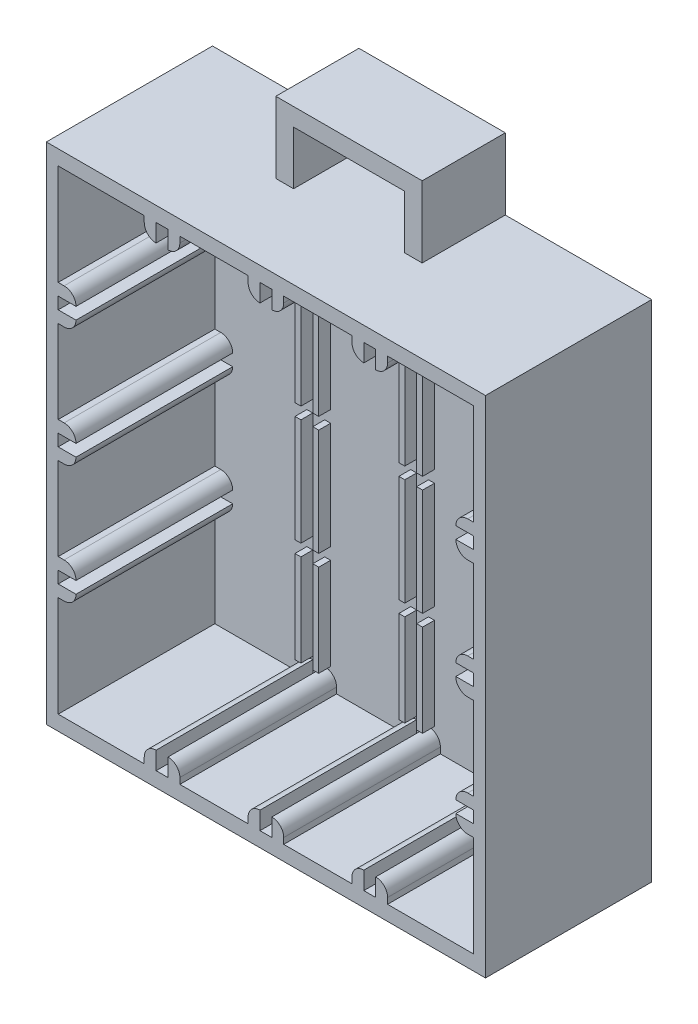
SolidWorks part; units mm, degrees
ref_plane "Alzado" through (0, 0, 0) normal (0, 0, 1) x (1, 0, 0)
ref_plane "Planta" through (0, 0, 0) normal (0, 1, 0) x (1, 0, 0)
ref_plane "Vista lateral" through (0, 0, 0) normal (1, 0, 0) x (0, 0, -1)
sketch "Croquis1" plane through (0, 0, 0) normal (0, 0, -1) x (-1, 0, 0)
  line L1 (-37, 42.5) -> (37, 42.5)
  line L2 (-37, 42.5) -> (-37, -42.5)
  line L3 (-37, -42.5) -> (37, -42.5)
  line L4 (37, 42.5) -> (37, -42.5)
  dimension "D1" = 85
  dimension "D2" = 74
extrude "Saliente-Extruir1" add sketch "Croquis1" against normal blind 1.6 separate body
sketch "Croquis4" plane through (0, 0, 1.6) normal (0, 0, 1) x (1, 0, 0)
  line L0 (-37, 42.5) -> (37, 42.5) construction
  line L1 (-35, 40) -> (35, 40)
  line L2 (-35, 40) -> (-35, -40)
  line L3 (-35, -40) -> (35, -40)
  line L4 (35, 40) -> (35, -40)
  line L5 (37, -42.5) -> (-37, -42.5)
  line L6 (37, -42.5) -> (37, 42.5)
  line L7 (37, 42.5) -> (-37, 42.5)
  line L8 (-37, -42.5) -> (-37, 42.5)
  line L9 (37, 42.5) -> (37, -42.5) construction
  dimension "D1" = 85
  dimension "D2" = 2.5
  dimension "D3" = 80
  dimension "D4" = 70
  dimension "D5" = 2
extrude "Saliente-Extruir2" add sketch "Croquis4" along normal blind 26.4
sketch "Croquis5" plane through (0, 0, 0) normal (0, 0, -1) x (-1, 0, 0)
  line L0 (-12.3333, 42.5) -> (-12.3333, 54.5)
  line L1 (-12.3333, 54.5) -> (12.3333, 54.5)
  line L2 (12.3333, 54.5) -> (12.3333, 42.5)
  line L3 (12.3333, 42.5) -> (9.3333, 42.5)
  line L4 (9.3333, 42.5) -> (9.3333, 51.5)
  line L5 (9.3333, 51.5) -> (-9.3333, 51.5)
  line L6 (-9.3333, 51.5) -> (-9.3333, 42.5)
  line L7 (-9.3333, 42.5) -> (-12.3333, 42.5)
extrude "Saliente-Extruir3" add sketch "Croquis5" against normal blind 14
sketch "Croquis8" plane through (-35, 0, 0) normal (1, 0, 0) x (0, 0, -1)
  line L0 (-1.6, 40) -> (-1.6, -40) construction
  line L1 (-1.6, -23) -> (-28, -23)
  line L2 (-1.6, -23) -> (-1.6, -21)
  line L3 (-1.6, -21) -> (-28, -21)
  line L4 (-28, -23) -> (-28, -21)
  line L5 (-28, 40) -> (-28, -40) construction
  line L6 (-28, -40) -> (-1.6, -40) construction
  line L7 (-1.6, -19) -> (-28, -19)
  line L8 (-1.6, -19) -> (-1.6, -17)
  line L9 (-1.6, -17) -> (-28, -17)
  line L10 (-28, -19) -> (-28, -17)
  line L11 (-1.6, -3) -> (-28, -3)
  line L12 (-1.6, -3) -> (-1.6, -1)
  line L13 (-1.6, -1) -> (-28, -1)
  line L14 (-28, -3) -> (-28, -1)
  line L15 (-1.6, 1) -> (-28, 1)
  line L16 (-1.6, 1) -> (-1.6, 3)
  line L17 (-1.6, 3) -> (-28, 3)
  line L18 (-28, 1) -> (-28, 3)
  line L19 (-1.6, 17) -> (-28, 17)
  line L20 (-1.6, 17) -> (-1.6, 19)
  line L21 (-1.6, 19) -> (-28, 19)
  line L22 (-28, 17) -> (-28, 19)
  line L23 (-1.6, 21) -> (-28, 21)
  line L24 (-1.6, 21) -> (-1.6, 23)
  line L25 (-1.6, 23) -> (-28, 23)
  line L26 (-28, 21) -> (-28, 23)
  dimension "D1" = 2
  dimension "D2" = 2
  dimension "D3" = 2
  dimension "D4" = 17
  dimension "D5" = 3
extrude "Saliente-Extruir4" add sketch "Croquis8" along normal blind 3
sketch "Croquis9" plane through (35, 0, 0) normal (-1, 0, 0) x (0, 0, 1)
  line L0 (28, -40) -> (28, 40) construction
  line L1 (28, -23) -> (1.6, -23)
  line L2 (28, -23) -> (28, -21)
  line L3 (28, -21) -> (1.6, -21)
  line L4 (1.6, -23) -> (1.6, -21)
  line L5 (1.6, -40) -> (1.6, 40) construction
  line L6 (28, -40) -> (1.6, -40) construction
  line L7 (28, -19) -> (1.6, -19)
  line L8 (28, -19) -> (28, -17)
  line L9 (28, -17) -> (1.6, -17)
  line L10 (1.6, -19) -> (1.6, -17)
  line L11 (28, -3) -> (1.6, -3)
  line L12 (28, -1) -> (1.6, -1)
  line L13 (1.6, -3) -> (1.6, -1)
  line L14 (1.6, 1) -> (1.6, 3)
  line L15 (28, 1) -> (1.6, 1)
  line L16 (28, 3) -> (1.6, 3)
  line L17 (28, 1) -> (28, 3)
  line L18 (28, -3) -> (28, -1)
  line L19 (28, 17) -> (1.6, 17)
  line L20 (28, 19) -> (1.6, 19)
  line L21 (1.6, 17) -> (1.6, 19)
  line L22 (1.6, 21) -> (1.6, 23)
  line L23 (28, 21) -> (1.6, 21)
  line L24 (28, 23) -> (1.6, 23)
  line L25 (28, 21) -> (28, 23)
  line L26 (28, 17) -> (28, 19)
  dimension "D1" = 2
  dimension "D2" = 2
  dimension "D3" = 2
  dimension "D4" = 19
  dimension "D5" = 3
extrude "Saliente-Extruir5" add sketch "Croquis9" along normal blind 3
sketch "Croquis10" plane through (0, -40, 0) normal (0, 1, 0) x (1, 0, 0)
  line L0 (-35, -1.6) -> (35, -1.6) construction
  line L1 (-20.5, -1.6) -> (-18.5, -1.6)
  line L2 (-20.5, -1.6) -> (-20.5, -28)
  line L3 (-20.5, -28) -> (-18.5, -28)
  line L4 (-18.5, -1.6) -> (-18.5, -28)
  line L5 (-35, -28) -> (35, -28) construction
  line L6 (-35, -28) -> (-35, -1.6) construction
  line L7 (-16.5, -1.6) -> (-14.5, -1.6)
  line L8 (-16.5, -1.6) -> (-16.5, -28)
  line L9 (-16.5, -28) -> (-14.5, -28)
  line L10 (-14.5, -1.6) -> (-14.5, -28)
  line L11 (3, -1.6) -> (3, -28)
  line L12 (1, -1.6) -> (1, -28)
  line L13 (-1, -1.6) -> (-1, -28)
  line L14 (-3, -1.6) -> (-3, -28)
  line L15 (1, -28) -> (3, -28)
  line L16 (-3, -28) -> (-1, -28)
  line L17 (1, -1.6) -> (3, -1.6)
  line L18 (-3, -1.6) -> (-1, -1.6)
  line L19 (20.5, -1.6) -> (20.5, -28)
  line L20 (18.5, -1.6) -> (18.5, -28)
  line L21 (16.5, -1.6) -> (16.5, -28)
  line L22 (14.5, -1.6) -> (14.5, -28)
  line L23 (18.5, -28) -> (20.5, -28)
  line L24 (14.5, -28) -> (16.5, -28)
  line L25 (18.5, -1.6) -> (20.5, -1.6)
  line L26 (14.5, -1.6) -> (16.5, -1.6)
  dimension "D1" = 2
  dimension "D2" = 2
  dimension "D3" = 2
  dimension "D4" = 16.5
  dimension "D5" = 3
extrude "Saliente-Extruir6" add sketch "Croquis10" along normal blind 3
sketch "Croquis11" plane through (0, 40, 0) normal (0, -1, 0) x (1, 0, 0)
  line L0 (35, 1.6) -> (-35, 1.6) construction
  line L1 (-20.5, 1.6) -> (-18.5, 1.6)
  line L2 (-20.5, 1.6) -> (-20.5, 28)
  line L3 (-20.5, 28) -> (-18.5, 28)
  line L4 (-18.5, 1.6) -> (-18.5, 28)
  line L5 (35, 28) -> (-35, 28) construction
  line L7 (-16.5, 1.6) -> (-14.5, 1.6)
  line L8 (-16.5, 1.6) -> (-16.5, 28)
  line L9 (-16.5, 28) -> (-14.5, 28)
  line L10 (-14.5, 1.6) -> (-14.5, 28)
  line L11 (-35, 28) -> (-35, 1.6) construction
  line L12 (-3, 1.6) -> (-3, 28)
  line L13 (-1, 1.6) -> (-1, 28)
  line L14 (1, 1.6) -> (1, 28)
  line L15 (3, 1.6) -> (3, 28)
  line L16 (1, 28) -> (3, 28)
  line L17 (-3, 28) -> (-1, 28)
  line L18 (-3, 1.6) -> (-1, 1.6)
  line L19 (1, 1.6) -> (3, 1.6)
  line L20 (14.5, 1.6) -> (14.5, 28)
  line L21 (16.5, 1.6) -> (16.5, 28)
  line L22 (18.5, 1.6) -> (18.5, 28)
  line L23 (20.5, 1.6) -> (20.5, 28)
  line L24 (18.5, 28) -> (20.5, 28)
  line L25 (14.5, 28) -> (16.5, 28)
  line L26 (14.5, 1.6) -> (16.5, 1.6)
  line L27 (18.5, 1.6) -> (20.5, 1.6)
  dimension "D1" = 2
  dimension "D2" = 2
  dimension "D3" = 2
  dimension "D4" = 16.5
  dimension "D5" = 3
extrude "Saliente-Extruir7" add sketch "Croquis11" along normal blind 3
fillet "Redondeo1" radius 2 24 edges at (-32, 23, 14.8) (-32, 17, 14.8) (-32, 3, 14.8) (-32, -3, 14.8) (-32, -17, 14.8) (-32, -23, 14.8) (32, 23, 14.8) (32, 17, 14.8) (32, 3, 14.8) (32, -3, 14.8) (32, -17, 14.8) (32, -23, 14.8) (20.5, -37, 14.8) (14.5, -37, 14.8) (3, -37, 14.8) (-3, -37, 14.8) (-14.5, -37, 14.8) (-20.5, -37, 14.8) (20.5, 37, 14.8) (14.5, 37, 14.8) (3, 37, 14.8) (-3, 37, 14.8) (-14.5, 37, 14.8) (-20.5, 37, 14.8)
sketch "Croquis12" plane through (0, 0, 1.6) normal (0, 0, 1) x (1, 0, 0)
  line L0 (18.5, -36.5) -> (18.5, -21)
  line L1 (18.5, -19) -> (18.5, -1)
  line L2 (19.5, -21) -> (18.5, -21)
  line L3 (19.5, -19) -> (19.5, -1)
  line L4 (19.5, -36.5) -> (19.5, -21)
  line L5 (15.5, -36.5) -> (15.5, -21)
  line L6 (18.5, -36.5) -> (19.5, -36.5)
  line L7 (16.5, -36.5) -> (15.5, -36.5)
  line L8 (19.5, 36.5) -> (18.5, 36.5)
  line L9 (16.5, -21) -> (16.5, -36.5)
  line L10 (19.5, -19) -> (18.5, -19)
  line L11 (19.5, 19) -> (18.5, 19)
  line L12 (16.5, -21) -> (15.5, -21)
  line L14 (19.5, 21) -> (18.5, 21)
  line L16 (19.5, 1) -> (18.5, 1)
  line L17 (19.5, -1) -> (18.5, -1)
  line L18 (16.5, 36.5) -> (16.5, 21)
  line L19 (15.5, -19) -> (15.5, -1)
  line L20 (15.5, 36.5) -> (16.5, 36.5)
  line L21 (16.5, -19) -> (15.5, -19)
  line L22 (19.5, 1) -> (19.5, 19)
  line L23 (18.5, 1) -> (18.5, 19)
  line L24 (16.5, -1) -> (16.5, -19)
  line L25 (15.5, 1) -> (15.5, 19)
  line L26 (16.5, -1) -> (15.5, -1)
  line L27 (16.5, 1) -> (15.5, 1)
  line L28 (19.5, 21) -> (19.5, 36.5)
  line L29 (18.5, 21) -> (18.5, 36.5)
  line L30 (16.5, 19) -> (16.5, 1)
  line L31 (15.5, 21) -> (15.5, 36.5)
  line L32 (16.5, 19) -> (15.5, 19)
  line L33 (16.5, 21) -> (15.5, 21)
  line L34 (1, -36.5) -> (1, -21)
  line L35 (1, -19) -> (1, -1)
  line L36 (2, -21) -> (1, -21)
  line L37 (2, -19) -> (2, -1)
  line L38 (2, -36.5) -> (2, -21)
  line L39 (-2, -36.5) -> (-2, -21)
  line L40 (1, -36.5) -> (2, -36.5)
  line L41 (-1, -36.5) -> (-2, -36.5)
  line L42 (2, 36.5) -> (1, 36.5)
  line L43 (-1, -21) -> (-1, -36.5)
  line L44 (2, -19) -> (1, -19)
  line L45 (2, 19) -> (1, 19)
  line L46 (-1, -21) -> (-2, -21)
  line L47 (2, 21) -> (1, 21)
  line L48 (2, 1) -> (1, 1)
  line L49 (2, -1) -> (1, -1)
  line L50 (-1, 36.5) -> (-1, 21)
  line L51 (-2, -19) -> (-2, -1)
  line L52 (-2, 36.5) -> (-1, 36.5)
  line L53 (-1, -19) -> (-2, -19)
  line L54 (2, 1) -> (2, 19)
  line L55 (1, 1) -> (1, 19)
  line L56 (-1, -1) -> (-1, -19)
  line L57 (-2, 1) -> (-2, 19)
  line L58 (-1, -1) -> (-2, -1)
  line L59 (-1, 1) -> (-2, 1)
  line L60 (2, 21) -> (2, 36.5)
  line L61 (1, 21) -> (1, 36.5)
  line L62 (-1, 19) -> (-1, 1)
  line L63 (-2, 21) -> (-2, 36.5)
  line L64 (-1, 19) -> (-2, 19)
  line L65 (-1, 21) -> (-2, 21)
  line L66 (-16.5, -36.5) -> (-16.5, -21)
  line L67 (-16.5, -19) -> (-16.5, -1)
  line L68 (-15.5, -21) -> (-16.5, -21)
  line L69 (-15.5, -19) -> (-15.5, -1)
  line L70 (-15.5, -36.5) -> (-15.5, -21)
  line L71 (-19.5, -36.5) -> (-19.5, -21)
  line L72 (-16.5, -36.5) -> (-15.5, -36.5)
  line L73 (-18.5, -36.5) -> (-19.5, -36.5)
  line L74 (-15.5, 36.5) -> (-16.5, 36.5)
  line L75 (-18.5, -21) -> (-18.5, -36.5)
  line L76 (-15.5, -19) -> (-16.5, -19)
  line L77 (-15.5, 19) -> (-16.5, 19)
  line L78 (-18.5, -21) -> (-19.5, -21)
  line L79 (-15.5, 21) -> (-16.5, 21)
  line L80 (-15.5, 1) -> (-16.5, 1)
  line L81 (-15.5, -1) -> (-16.5, -1)
  line L82 (-18.5, 36.5) -> (-18.5, 21)
  line L83 (-19.5, -19) -> (-19.5, -1)
  line L84 (-19.5, 36.5) -> (-18.5, 36.5)
  line L85 (-18.5, -19) -> (-19.5, -19)
  line L86 (-15.5, 1) -> (-15.5, 19)
  line L87 (-16.5, 1) -> (-16.5, 19)
  line L88 (-18.5, -1) -> (-18.5, -19)
  line L89 (-19.5, 1) -> (-19.5, 19)
  line L90 (-18.5, -1) -> (-19.5, -1)
  line L91 (-18.5, 1) -> (-19.5, 1)
  line L92 (-15.5, 21) -> (-15.5, 36.5)
  line L93 (-16.5, 21) -> (-16.5, 36.5)
  line L94 (-18.5, 19) -> (-18.5, 1)
  line L95 (-19.5, 21) -> (-19.5, 36.5)
  line L96 (-18.5, 19) -> (-19.5, 19)
  line L97 (-18.5, 21) -> (-19.5, 21)
  dimension "D1" = 1
  dimension "D2" = 1
  dimension "D4" = 0.5
  dimension "D5" = 0.5
  dimension "D6" = 0.5
  dimension "D7" = 0.5
  dimension "D3" = 3
extrude "Saliente-Extruir9" add sketch "Croquis12" along normal blind 2
